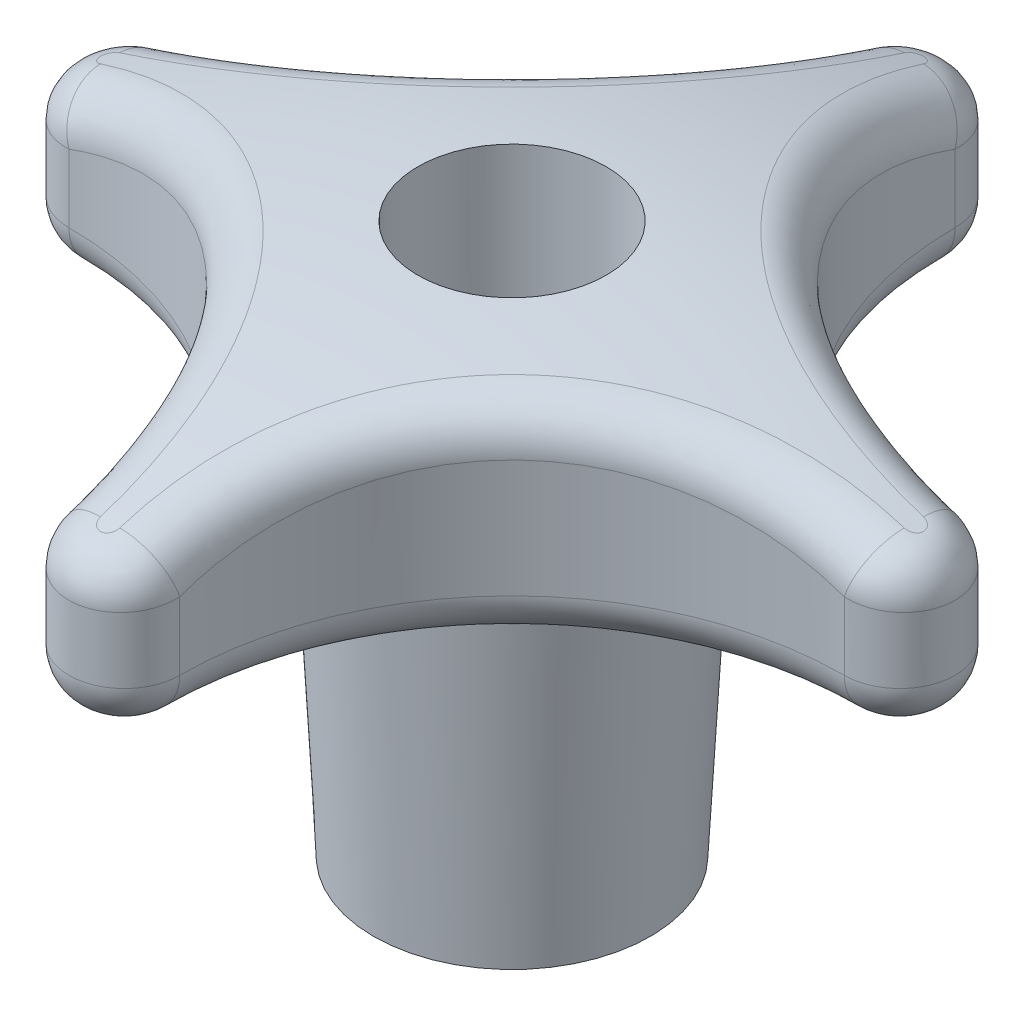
SolidWorks part; units mm, degrees
ref_plane "Front Plane" through (0, 0, 0) normal (0, 0, 1) x (1, 0, 0)
ref_plane "Top Plane" through (0, 0, 0) normal (0, 1, 0) x (1, 0, 0)
ref_plane "Right Plane" through (0, 0, 0) normal (1, 0, 0) x (0, 0, -1)
sketch "Sketch1" plane through (0, 0, 0) normal (0, 1, 0) x (1, 0, 0)
  circle A0 centre (0, 0) radius 12.5
  dimension "D1" = 25
extrude "Extrude1" add sketch "Sketch1" against normal blind 30
draft "Draft1" type of draft neutral plane draft angle 3 faces to draft 1 parameters "D1"=3
sketch "Sketch2" plane through (0, 0, 0) normal (0, 0, 1) x (1, 0, 0)
  line L0 (0, 0) -> (-40, 0)
  line L1 (-40, 0) -> (-40, 13)
  line L2 (0, 0) -> (0, 50000) construction
  line L3 (0, 20) -> (20.2547, 20) construction
  line L4 (0, 0) -> (0, 20)
  arc A0 (0, 20) -> (-40, 13) centre (0, -97.7857) ccw
revolve "Revolve1" add sketch "Sketch2" angle 360 about L2
sketch "Sketch4" plane through (0, 0, 0) normal (0, 1, 0) x (1, 0, 0)
  line L0 (0, 0) -> (-50000, 0) construction
  line L1 (0, 0) -> (0, 50000) construction
  line L2 (-35, 5) -> (-45.9117, 5) construction
  line L3 (-5, 35) -> (-5, 40.3224) construction
  arc A0 (0, 40) -> (-5, 35) centre (0, 35) ccw
  arc A1 (-35, 5) -> (-40, 0) centre (-35, 0) ccw
  circle A2 centre (0, 0) radius 40 construction
  arc A3 (-35, 5) -> (-5, 35) centre (-35, 35) ccw
  arc A4 (0, 40) -> (-40, 0) centre (-40, 40) ccw
  point P9 (0, 40)
  point P10 (-40, 0)
  point P13 (-5, 35)
  point P14 (-35, 5)
extrude "Extrude3" cut sketch "Sketch4" along normal through all
pattern_circular "CirPattern1" count 4 over 360 about axis through (0, 0, 0) along (0, 1, 0) of "Extrude3"
fillet "Fillet2" radius 4.1667 16 edges at (0, 0, 40) (13.7868, 0, 13.7868) (40, 0, 0) (13.7868, 0, -13.7868) (0, 0, -40) (-13.7868, 0, -13.7868) (-40, 0, 0) (-0.0002, 13, 40) (16.8148, 18.2601, 11.14) (40, 13, 0.0002) (11.14, 18.2601, -16.8148) (0.0002, 13, -40) (-16.8148, 18.2601, -11.14) (-40, 13, 0.0002) (-13.7868, 0, 13.7868) (-11.14, 18.2601, 16.8148)
fillet "Fillet3" radius 2.0833 1 edges at (0, 0, 14.0722)
sketch "Sketch6" [suppressed] plane through (0, -30, 0) normal (0, -1, 0) x (1, 0, 0)
  circle A0 centre (0, 0) radius 8
  dimension "D1" = 8
extrude "Extrude5" [suppressed] cut sketch "Sketch6" against normal blind 18
sketch "Sketch7" [suppressed] plane through (0, 0, 0) normal (0, 0, 1) x (1, 0, 0)
  line L0 (0, 2) -> (8, 2)
  line L1 (8, -30) -> (8, 2) construction
  line L2 (8, 2) -> (0, 6.6188)
  line L3 (0, 6.6188) -> (0, 2)
  line L4 (-8, -30) -> (8, -30) construction
revolve "Cut-Revolve1" [suppressed] cut sketch "Sketch7" angle 360 about L3
sketch "Sketch8" plane through (0, -30, 0) normal (0, -1, 0) x (1, 0, 0)
  circle A0 centre (0, 0) radius 8
  dimension "D1" = 16
extrude "Extrude6" cut sketch "Sketch8" against normal blind 20
sketch "Sketch9" plane through (0, -10, 0) normal (0, -1, 0) x (1, 0, 0)
  circle A0 centre (0, 0) radius 8.5
  dimension "D1" = 17
extrude "Extrude7" cut sketch "Sketch9" against normal through all
sketch "Sketch10" [suppressed] plane through (0, -24, 0) normal (0, -1, 0) x (1, 0, 0)
  circle A0 centre (0, 0) radius 6
extrude "Extrude8" [suppressed] cut sketch "Sketch10" against normal blind 15
sketch "Sketch11" [suppressed] plane through (0, 0, 0) normal (0, 0, 1) x (1, 0, 0)
  line L0 (5.1, 7.0555) -> (5.1, -2)
  line L1 (0, 0) -> (0, -5.4531) construction
  line L2 (5.1, 7.0555) -> (0, 10)
  line L3 (0, 10) -> (0, -2)
  line L4 (-6, -2) -> (6, -2) construction
  line L5 (5.1, -2) -> (0, -2)
revolve "Cut-Revolve2" [suppressed] cut sketch "Sketch11" angle 360 about L3
equation "\"D2@Sketch2\" = \"D1@Sketch2\"*.65"
equation "\"D1@Sketch4\" = (\"D3@Sketch2\"*2)/8"
equation "\"D2@Sketch4\" =( \"D3@Sketch2\"*2)/8"
equation "\"D1@Sketch7\" = \"D1@Extrude5\""
equation "\"D1@Fillet3\" = \"D1@Fillet2\"/2"
equation "\"D2@Sketch11\" = \"D1@Sketch10\""
